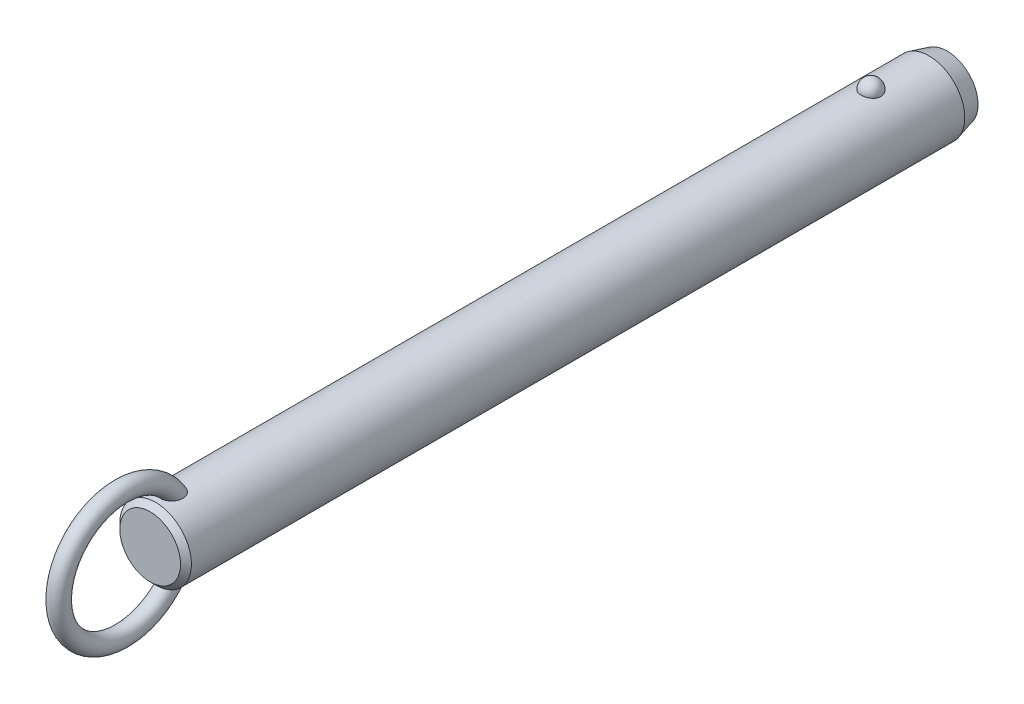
SolidWorks part; units mm, degrees
ref_plane "Front Plane" through (0, 0, 0) normal (0, 0, 1) x (1, 0, 0)
ref_plane "Top Plane" through (0, 0, 0) normal (0, 1, 0) x (1, 0, 0)
ref_plane "Right Plane" through (0, 0, 0) normal (1, 0, 0) x (0, 0, -1)
sketch "Sketch2" plane through (0, 0, 0) normal (0, 0, 1) x (1, 0, 0)
  circle A0 centre (0, 0) radius 7.9
  point P3 (0, 7.9)
  dimension "D1" = 15.8
extrude "Boss-Extrude1" add sketch "Sketch2" along normal blind 147.3
sketch "Sketch3" plane through (0, 0, 0) normal (0, 0, -1) x (-1, 0, 0)
  circle A0 centre (0, 0) radius 7.9
  dimension "D1" = 15.8
extrude "Boss-Extrude2" add sketch "Sketch3" along normal blind 19
chamfer "Chamfer1" distance 4 angle 15 1 edges at (-7.9, 0, -19)
sketch "Sketch12" plane through (0, 0, 0) normal (1, 0, 0) x (0, 0, -1)
  line L0 (-147.3, 7.9) -> (-147.3, -7.9) construction
  point P0 (-147.3, 0)
sketch "Sketch13" plane through (0, 0, 0) normal (1, 0, 0) x (0, 0, -1)
  circle A0 centre (-163.15, 0) radius 15.85
  point P2 (-147.3, 0)
  dimension "D1" = 31.7
sketch "Sketch14" plane through (0, 0, 0) normal (0, 1, 0) x (1, 0, 0)
  circle A0 centre (0, -149.3) radius 2
  point P2 (0, -147.3)
  dimension "D1" = 4
sweep "Sweep1" add profiles "Sketch14" path "Sketch13"
sketch "Sketch15" plane through (0, 0, 147.3) normal (0, 0, 1) x (1, 0, 0)
  circle A0 centre (0, 0) radius 7.9
  dimension "D1" = 15.8
extrude "Boss-Extrude3" add sketch "Sketch15" along normal blind 9.52
chamfer "Chamfer2" distance 1.2 angle 45 1 edges at (7.9, 0, 156.82)
sketch "Sketch18" plane through (0, 0, 0) normal (1, 0, 0) x (0, 0, -1)
  line L0 (15, 7.9) -> (-149.4091, 7.9) construction
  line L1 (2.2, 10.1) -> (2.2, 5.7)
  line L2 (-149.4091, -7.9) -> (15, -7.9) construction
  arc A0 (2.2, 10.1) -> (2.2, 5.7) centre (2.2, 7.9) ccw
  point P4 (0, 7.9)
  dimension "D1" = 18
revolve "Revolve1" add sketch "Sketch18" angle 360 about L1
